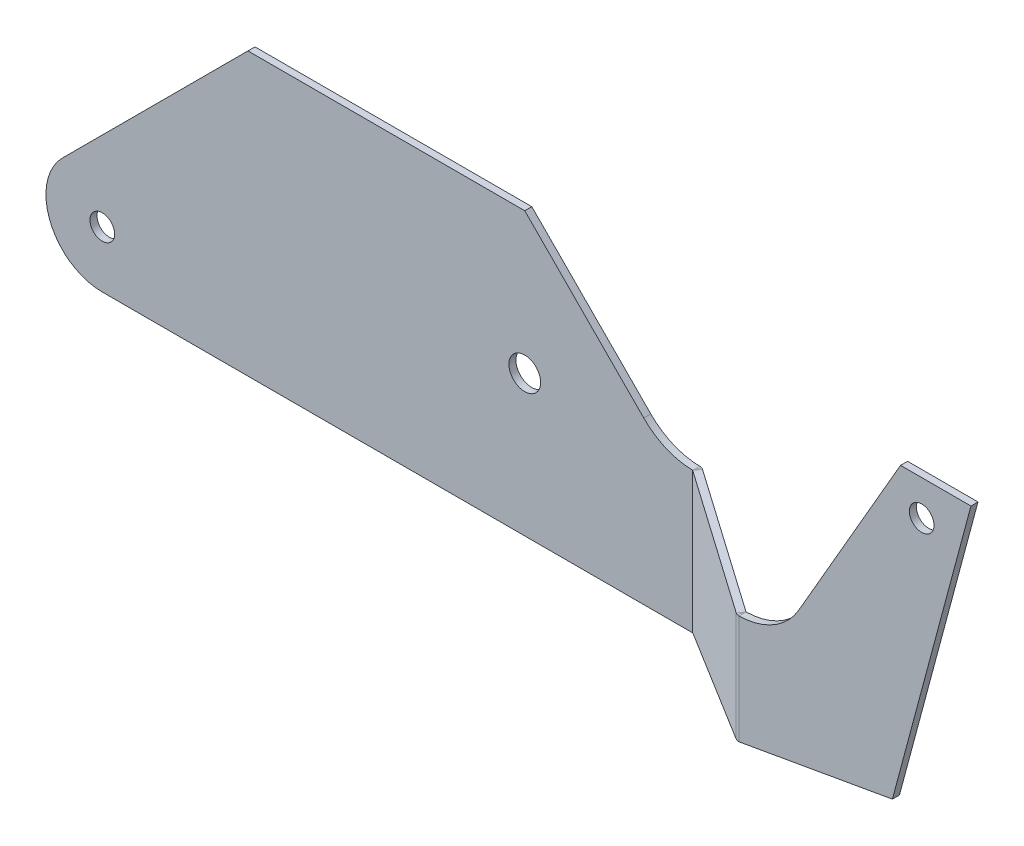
SolidWorks part; units mm, degrees
ref_plane "Front" through (0, 0, 0) normal (0, 0, 1) x (1, 0, 0)
ref_plane "Top" through (0, 0, 0) normal (0, 1, 0) x (1, 0, 0)
ref_plane "Right" through (0, 0, 0) normal (1, 0, 0) x (0, 0, -1)
sketch "Sketch1" plane through (0, 0, 0) normal (0, 0, 1) x (1, 0, 0)
  line L0 (49.5, 20) -> (24, 20)
  line L1 (24, 0) -> (71.4378, 8.3646)
  line L2 (24, 0) -> (-60, 0)
  line L4 (0, 40) -> (-39.3137, 40)
  line L5 (-65.6569, 13.6569) -> (-39.3137, 40)
  line L7 (82.594, 50) -> (72.594, 50)
  line L8 (0, 50) -> (-39.3137, 50) construction
  line L11 (0, 40) -> (16.8994, 22.9586)
  line L13 (58.1602, 25) -> (72.594, 50)
  line L16 (82.594, 50) -> (71.4378, 8.3646)
  circle A0 centre (-60, 8) radius 1.75
  arc A1 (-65.6569, 13.6569) -> (-60, 0) centre (-60, 8) ccw
  arc A2 (16.8994, 22.9586) -> (24, 20) centre (24, 30) ccw
  arc A3 (49.5, 20) -> (58.1602, 25) centre (49.5, 30) ccw
  circle A4 centre (0, 20) radius 2.25
  circle A5 centre (75.594, 45) radius 1.75
sheet metal parameters "Sheet-Metal1" thickness 1 parameters "D1"=0.01
base flange "Base-Flange1" sketch "Sketch1" thickness 1 reverse thickness direction yes parameters "D1"=0.01
sketch "Sketch3" plane through (0, 0, 1) normal (0, 0, 1) x (1, 0, 0)
  line L0 (24, 30) -> (24, 0)
sketched bend "Sketched Bend1" parameters "D1"=0.01
bend "SketchBend1" bend radius 0.01 bend angle 35 parameters "D5"=1
sketch "Sketch4" plane through (7.3757, 0, -10.5336) normal (-0.5736, 0, 0.8192) x (0.8192, 0, 0.5736)
  line L0 (45.4556, 30) -> (45.4556, -10.8992)
sketched bend "Sketched Bend2" parameters "D1"=0.01
bend "SketchBend2" bend radius 0.01 bend angle 35 parameters "D5"=2
flat pattern "Flat-Pattern1"
sketch "Bend-Lines1" plane through (0, 0, 1) normal (0, 0, 1) x (1, 0, 0)
  line L0 (49.5, 4.4963) -> (49.5, 20) construction
  line L1 (24, 0) -> (24, 20) construction
bend of the flat pattern "Flatten-<SketchBend1>1"
bend of the flat pattern "Flatten-<SketchBend2>1"
